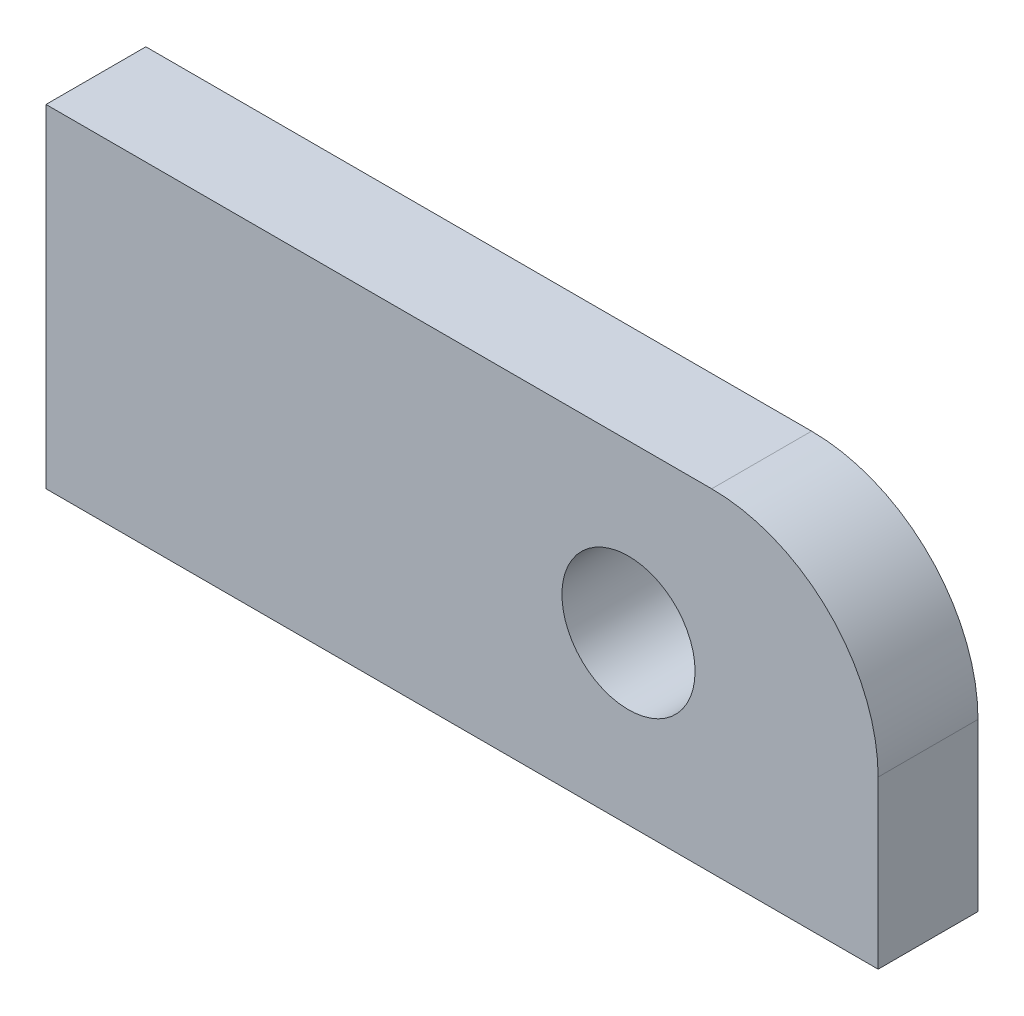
SolidWorks part; units mm, degrees
ref_plane "Face" through (0, 0, 0) normal (0, 0, 1) x (1, 0, 0)
ref_plane "Dessus" through (0, 0, 0) normal (0, 1, 0) x (1, 0, 0)
ref_plane "Droite" through (0, 0, 0) normal (1, 0, 0) x (0, 0, -1)
sketch "Esquisse1" plane through (0, 0, 0) normal (0, 0, 1) x (1, 0, 0)
  line L1 (0, 0) -> (100, 0)
  line L2 (0, 0) -> (0, 40)
  line L3 (0, 40) -> (80, 40)
  line L4 (100, 0) -> (100, 20)
  arc A0 (100, 20) -> (80, 40) centre (80, 20) ccw
  circle A1 centre (70, 20) radius 8
  dimension "D3" = 20
  dimension "D4" = 16
  dimension "D1" = 40
  dimension "D2" = 100
  dimension "D5" = 20
  dimension "D6" = 70
extrude "Base-Extrusion" add sketch "Esquisse1" along normal blind 12
